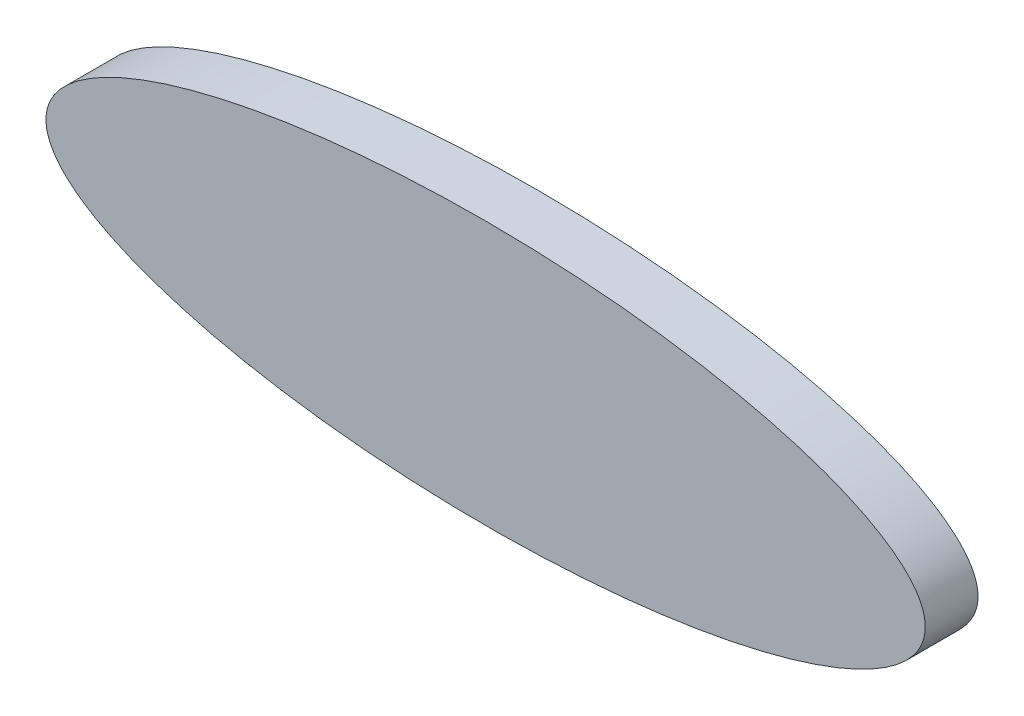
SolidWorks part; units mm, degrees
ref_plane "Front" through (0, 0, 0) normal (0, 0, 1) x (1, 0, 0)
ref_plane "Top" through (0, 0, 0) normal (0, 1, 0) x (1, 0, 0)
ref_plane "Right" through (0, 0, 0) normal (1, 0, 0) x (0, 0, -1)
sketch "Sketch1" plane through (0, 0, 0) normal (0, 0, 1) x (1, 0, 0)
  ellipse E0 centre (0, 0) end of major axis (25, 0) minor radius 7.5
  dimension "D1" = 15
  dimension "D2" = 50
extrude "Extrude1" add sketch "Sketch1" along normal blind 3
sketch "Sketch2" plane through (0, 0, 3) normal (0, 0, 1) x (1, 0, 0)
  circle A0 centre (-10, 6.8739) radius 3.5
  ellipse E1 centre (0, 0) end of major axis (25, 0) minor radius 7.5 construction
  dimension "D1" = 7
  dimension "D2" = 10
